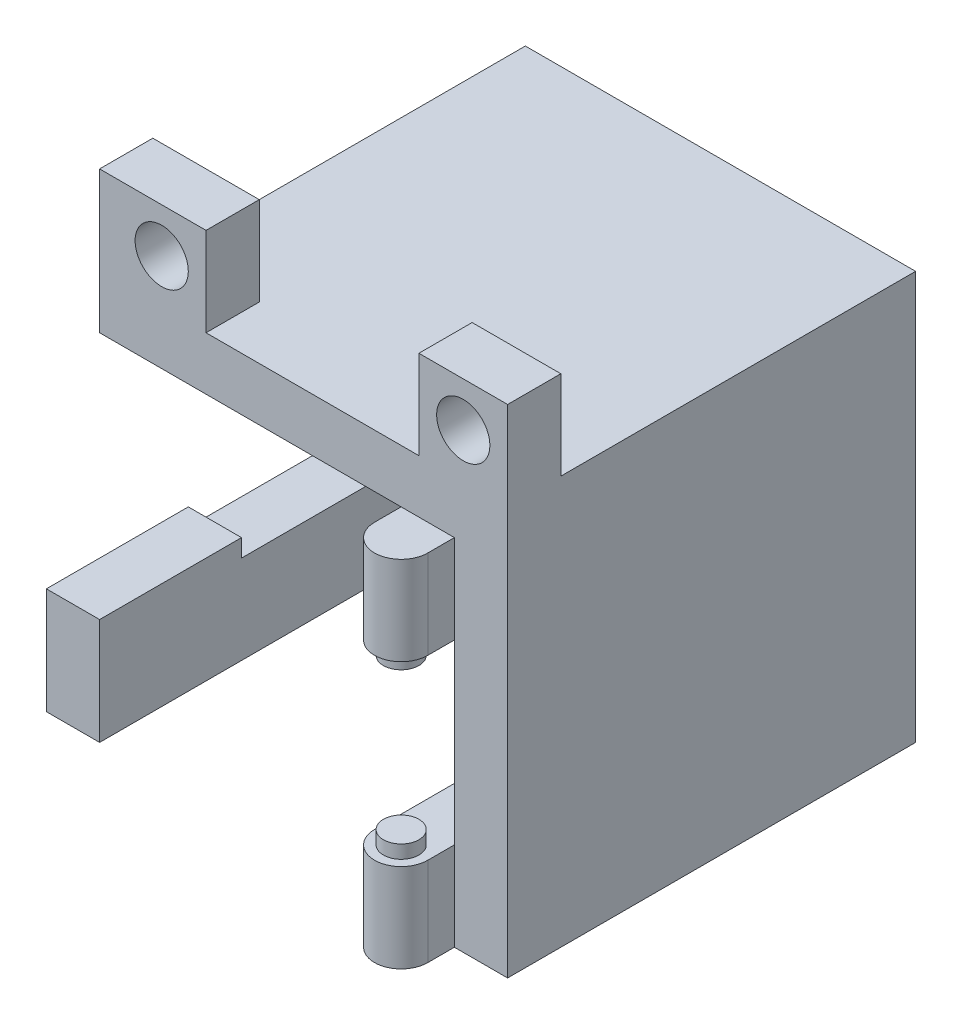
SolidWorks part; units mm, degrees
ref_plane "Alzado" through (0, 0, 0) normal (0, 0, 1) x (1, 0, 0)
ref_plane "Planta" through (0, 0, 0) normal (0, 1, 0) x (1, 0, 0)
ref_plane "Vista lateral" through (0, 0, 0) normal (1, 0, 0) x (0, 0, -1)
sketch "Croquis1" plane through (0, 0, 0) normal (0, 1, 0) x (1, 0, 0)
  line L1 (-13, -11.5) -> (13, -11.5)
  line L2 (-13, -11.5) -> (-13, 11.5)
  line L3 (-13, 11.5) -> (13, 11.5)
  line L4 (13, -11.5) -> (13, 11.5)
  line L5 (-13, -11.5) -> (13, 11.5) construction
  line L6 (-13, 11.5) -> (13, -11.5) construction
  point P0 (0, 0)
  dimension "D1" = 23
  dimension "D2" = 26
extrude "Saliente-Extruir1" add sketch "Croquis1" along normal blind 23
sketch "Croquis2" plane through (0, 0, 11.5) normal (0, 0, 1) x (1, 0, 0)
  line L0 (-13, 0) -> (13, 0) construction
  line L1 (-10, 20) -> (10, 20)
  line L2 (-10, 20) -> (-10, 0)
  line L3 (-10, 0) -> (10, 0)
  line L4 (10, 20) -> (10, 0)
  line L5 (-13, 23) -> (-13, 0) construction
  dimension "D1" = 3
  dimension "D2" = 20
  dimension "D3" = 20
extrude "Cortar-Extruir1" cut sketch "Croquis2" against normal blind 20
sketch "Croquis5" plane through (0, 0, 11.5) normal (0, 0, 1) x (1, 0, 0)
  line L9 (-13, 23) -> (13, 23) construction
  line L14 (-13, 23) -> (-9, 23)
  line L15 (-13, 23) -> (-13, 5)
  line L16 (-13, 5) -> (-9, 5)
  line L17 (-9, 23) -> (-9, 20)
  line L18 (-9, 20) -> (-8, 20)
  line L20 (-9, 11) -> (-8, 11)
  line L21 (-8, 20) -> (-8, 11)
  line L22 (-9, 11) -> (-9, 5)
  dimension "D1" = 4
  dimension "D2" = 18
  dimension "D3" = 1
  dimension "D4" = 9
  dimension "D5" = 3
extrude "Cortar-Extruir3" cut sketch "Croquis5" against normal up to next
sketch "Croquis6" plane through (0, 0, 11.5) normal (0, 0, 1) x (1, 0, 0)
  line L1 (-9, 23) -> (-4, 23)
  line L2 (-9, 23) -> (-9, 28)
  line L3 (-9, 28) -> (-4, 28)
  line L4 (-4, 23) -> (-4, 28)
  line L5 (13, 23) -> (8, 23)
  line L6 (13, 23) -> (13, 28)
  line L7 (13, 28) -> (8, 28)
  line L8 (8, 23) -> (8, 28)
  dimension "D1" = 5
extrude "Saliente-Extruir2" add sketch "Croquis6" against normal blind 3
sketch "Croquis7" plane through (0, 0, 11.5) normal (0, 0, 1) x (1, 0, 0)
  line L0 (-9, 28) -> (-4, 23) construction
  line L1 (8, 23) -> (13, 28) construction
  circle A0 centre (-6.5, 25.5) radius 1.5
  circle A1 centre (10.5, 25.5) radius 1.5
  dimension "D1" = 3
  dimension "D2" = 3
extrude "Cortar-Extruir4" cut sketch "Croquis7" against normal blind 3
sketch "Croquis8" plane through (0, 5, 0) normal (0, 1, 0) x (1, 0, 0)
  line L0 (-10, -11.5) -> (-10, 8.5) construction
  line L1 (-13, -11.5) -> (-10, -11.5)
  line L2 (-13, -11.5) -> (-13, -3.5)
  line L3 (-13, -3.5) -> (-10, -3.5)
  line L4 (-10, -11.5) -> (-10, -3.5)
  dimension "D1" = 8
extrude "Saliente-Extruir3" add sketch "Croquis8" along normal blind 1
sketch "Croquis9" plane through (-9, 0, 0) normal (-1, 0, 0) x (0, 0, 1)
  line L0 (8.5, 23) -> (8.5, 28)
  line L1 (8.5, 28) -> (11.5, 28)
  line L2 (11.5, 28) -> (11.5, 20)
  line L3 (11.5, 20) -> (3.5, 20)
  line L4 (-11.5, 20) -> (11.5, 20) construction
  line L5 (3.5, 20) -> (3.5, 23)
  line L6 (-11.5, 23) -> (8.5, 23) construction
  line L7 (3.5, 23) -> (8.5, 23)
  dimension "D1" = 8
extrude "Saliente-Extruir4" add sketch "Croquis9" along normal blind 1
sketch "Croquis10" plane through (0, 0, 0) normal (0, -1, 0) x (1, 0, 0)
  line L0 (7, 8.5) -> (7, 11.5)
  line L1 (10, 11.5) -> (7, 11.5) construction
  line L2 (10, 11.5) -> (10, 8.5)
  line L3 (10, 8.5) -> (7, 8.5)
  line L4 (7, 11.5) -> (7, 13)
  line L5 (10, 11.5) -> (10, 13)
  arc A0 (10, 13) -> (7, 13) centre (8.5, 13) ccw
  dimension "D2" = 1.5
  dimension "D1" = 3
extrude "Saliente-Extruir5" add sketch "Croquis10" against normal blind 5
sketch "Croquis12" plane through (0, 5, 0) normal (0, 1, 0) x (1, 0, 0)
  circle A0 centre (8.5, -13) radius 1
  arc A3 (7, -13) -> (10, -13) centre (8.5, -13) ccw construction
  dimension "D1" = 2
extrude "Saliente-Extruir7" add sketch "Croquis12" along normal blind 0.75
ref_plane "Plano1" through (0, 10, 0) normal (0, -1, 0) x (-1, 0, 0)
mirror "Simetría1" about plane through (0, 10, 0) normal (0, -1, 0) of "Saliente-Extruir7", "Saliente-Extruir5"
